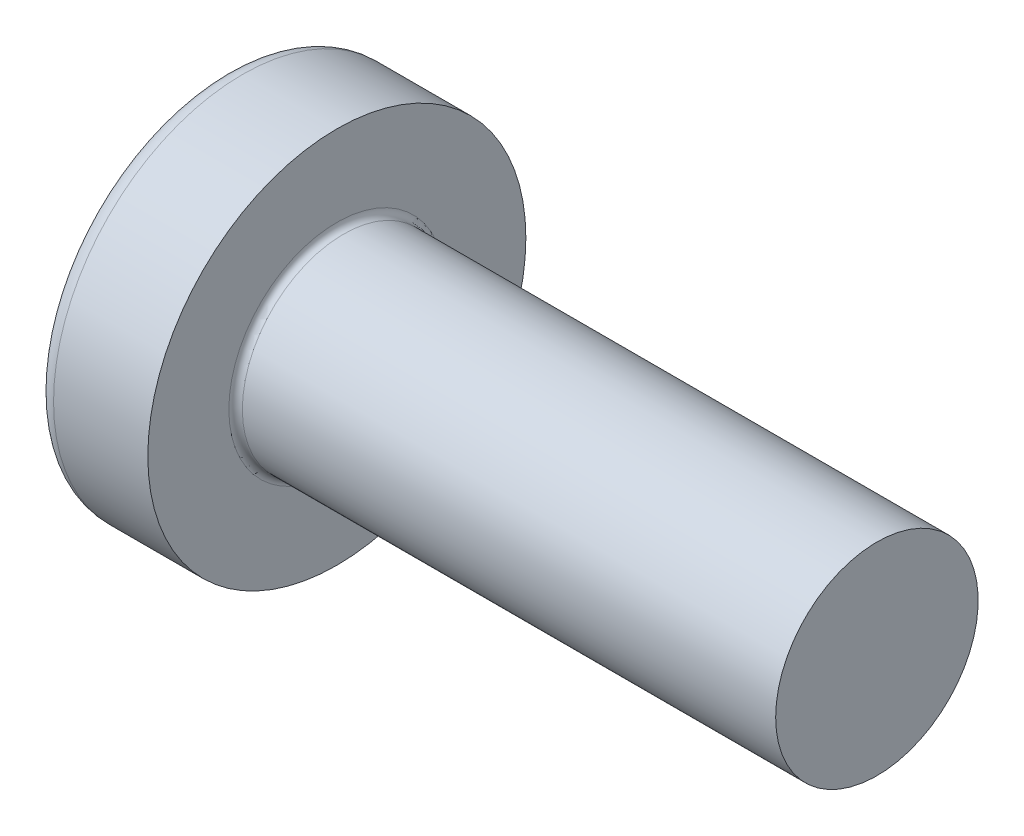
SolidWorks part; units mm, degrees
ref_plane "Plane1" through (0, 0, 0) normal (0, 0, 1) x (1, 0, 0)
ref_plane "Plane2" through (0, 0, 0) normal (0, 1, 0) x (1, 0, 0)
ref_plane "Plane3" through (0, 0, 0) normal (1, 0, 0) x (0, 0, -1)
revolve "Base-Revolve" add sketch "BodySke"
sketch "BodySke" plane through (0, 0, 0) normal (0, 0, 1) x (1, 0, 0)
  line L0 (2.4, 1.5) -> (2.4, 2.8)
  line L1 (2.65, 6.35) -> (2.65, -3.175) construction
  line L2 (-25.4, 0) -> (127, 0) construction
  line L3 (10.4, 0) -> (0, 0)
  line L4 (2.4, 1.5) -> (10.4, 1.5)
  line L5 (10.4, 1.5) -> (10.4, 0)
  line L6 (1.0035, 2.8) -> (2.4, 2.8)
  line L8 (2.4, 6.35) -> (2.4, -3.175) construction
  arc A0 (0.7754, 2.6744) -> (0, 0) centre (5, 0) ccw
  arc A2 (0.7754, 2.6744) -> (1.0035, 2.8) centre (1.0035, 2.53) cw
  dimension "Head_fillet_rad" = 0.27
  dimension "Head_crown_rad" = 5
  dimension "Head_ht" = 2.4
  dimension "Diameter" = 3
  dimension "Length" = 8
  dimension "Head_dia" = 5.6
  dimension "Advance" = 0.5
  dimension "Thread_nom" = 8
fillet "Fillet1" radius 0.1 1 edges at (2.4, 0, 1.5)
sketch "Sketch3" plane through (0, 0, 0) normal (1, 0, 0) x (0, 0, -1)
  line L0 (0.37, -1.4) -> (-0.37, -1.4)
  line L1 (0.37, -1.4) -> (0.37, 1.4)
  line L2 (-0.37, 1.4) -> (0.37, 1.4)
  line L3 (-0.37, 1.4) -> (-0.37, -1.4)
  dimension "D1" = 1.4
  dimension "Cross_dia" = 2.8
  dimension "D2" = 0.37
  dimension "Cross_width" = 0.74
ref_plane "Plane4" through (1.75, 0, 0) normal (1, 0, 0) x (0, 0, -1)
sketch "Sketch4" plane through (1.75, 0, 0) normal (1, 0, 0) x (0, 0, -1)
  line L0 (0.37, -0.5275) -> (-0.37, -0.5275)
  line L1 (0.37, -0.5275) -> (0.37, 0.5275)
  line L2 (-0.37, 0.5275) -> (0.37, 0.5275)
  line L3 (-0.37, 0.5275) -> (-0.37, -0.5275)
  dimension "D1" = 0.74
  dimension "D2" = 1.055
  dimension "D3" = 0.37
  dimension "D4" = 0.5275
loft "Recess" cut profiles "Sketch3", "Sketch4"
pattern_circular "RecPat" count 2 every 90 about axis through (0, 0, 0) along (1, 0, 0) of "Recess"
sketch "RecCorSke" plane through (0, 0, 0) normal (0, 0, 1) x (1, 0, 0)
  line L0 (-3.175, 0) -> (15.875, 0) construction
  line L1 (-25.4, 0) -> (127, 0) construction
  line L2 (0, 0) -> (0, 0.6784)
  line L3 (0, 0.6784) -> (1.75, 0.556)
  line L4 (1.75, 0.556) -> (1.9307, 0)
  line L5 (1.9307, 0) -> (0, 0)
  dimension "Diameter" = 1.112
  dimension "Depth" = 1.75
  dimension "Draft_angle" = 4
  dimension "Bottom_angle" = 18
revolve "RecessCore" cut sketch "RecCorSke" angle 360 about L0
sketch "ThdSchSke" plane through (0, 0, 0) normal (0, 0, 1) x (1, 0, 0)
  line L0 (3.4, -1.2195) -> (3.2036, -1.5)
  line L1 (3.4, -1.2195) -> (3.5964, -1.5)
  line L2 (3.5964, -1.5) -> (3.5964, -1.875)
  line L3 (-3.175, 0) -> (5.1513, 0) construction
  line L5 (3.5964, -1.875) -> (3.2036, -1.875)
  line L6 (3.2036, -1.875) -> (3.2036, -1.5)
  dimension "Thread_minor" = 2.439
  dimension "Diameter" = 3
  dimension "Start" = 3.4
  dimension "SideAngle" = 55
  dimension "VeeAngle" = 70
  dimension "Overcut" = 3.75
revolve "ThreadSchematic" [suppressed] cut sketch "ThdSchSke" angle 360 about L3
pattern_linear "ThdSchPat" [suppressed]
equation "\"D1@Sketch3\" = \"Cross_dia@Sketch3\" / 2"
equation "\"D2@Sketch3\" = \"Cross_width@Sketch3\" / 2"
equation "\"Depth@RecCorSke\" = \"Cross_depth@Plane4\""
equation "\"D1@Sketch4\" = \"Cross_width@Sketch3\""
equation "\"D2@Sketch4\" = \"Cross_dia@Sketch3\" - 2.0 * \"Cross_depth@Plane4\" * tan(26.5  * 0.017453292)"
equation "\"D3@Sketch4\" = \"D1@Sketch4\" / 2"
equation "\"D4@Sketch4\" = \"D2@Sketch4\" / 2"
equation "\"Thread_length@ThreadCosmetic\" = ((sgn( (\"Length@BodySke\" - \"Advance@BodySke\" * 2.0 ) - \"Thread_nom@BodySke\" )-1)*( (\"Length@BodySke\" - \"Advance@BodySke\" * 2.0 ) - \"Thread_nom@BodySke\" ))/-2+ \"Thread_"
equation "\"Thread_minor@ThdSchSke\" = \"Thread_minor@ThreadCosmetic\""
equation "\"Diameter@ThdSchSke\" = \"Diameter@BodySke\""
equation "\"Overcut@ThdSchSke\" = \"Diameter@BodySke\" * 1.25"
equation "\"Start@ThdSchSke\" = \"Head_ht@BodySke\" + \"Length@BodySke\" - \"Thread_length@ThreadCosmetic\"  '---Non-countersunk---"
equation "\"Num_threads@ThdSchPat\" = int( \"Thread_length@ThreadCosmetic\" / \"Advance@BodySke\" + 0.999 )  + 1"
equation "\"Advance@ThdSchPat\" = \"Thread_length@ThreadCosmetic\" /  (\"Num_threads@ThdSchPat\" - 1) 'relax it"
